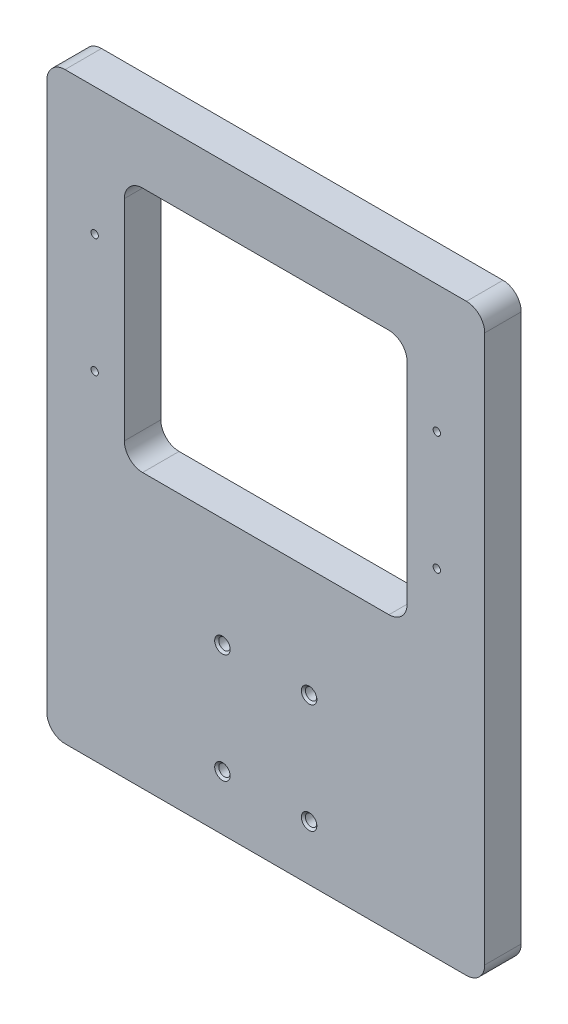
SolidWorks part; units mm, degrees
ref_plane "Front" through (0, 0, 0) normal (0, 0, 1) x (1, 0, 0)
ref_plane "Top" through (0, 0, 0) normal (0, 1, 0) x (1, 0, 0)
ref_plane "Right" through (0, 0, 0) normal (1, 0, 0) x (0, 0, -1)
sketch "Sketch1" plane through (0, 0, 0) normal (0, 0, 1) x (1, 0, 0)
  line L1 (0, 0) -> (304.8, 0)
  line L2 (0, 0) -> (0, 406.4)
  line L3 (0, 406.4) -> (304.8, 406.4)
  line L4 (304.8, 0) -> (304.8, 406.4)
  dimension "D1" = 304.8
  dimension "D2" = 406.4
extrude "Boss-Extrude1" add sketch "Sketch1" along normal blind 25.4 contours L3 L4 L1 L2
sketch "Snoot Location Ref." plane through (0, 0, 25.4) normal (0, 0, 1) x (1, 0, 0)
  line L0 (0, 0) -> (0, 406.4) construction
  line L1 (0, 0) -> (304.8, 0) construction
  circle A0 centre (152.4, 317.5) radius 27.051 construction
  circle A1 centre (152.4, 234.95) radius 27.051 construction
  circle A2 centre (193.675, 276.225) radius 12.7 construction
  circle A3 centre (111.125, 276.225) radius 12.7 construction
  dimension "D1" = 54.102
  dimension "D7" = 41.275
  dimension "D8" = 25.4
  dimension "D2" = 152.4
  dimension "D3" = 234.95
  dimension "D4" = 82.55
  dimension "D5" = 82.55
  dimension "D6" = 41.275
sketch "I-Beam Location Ref." plane through (0, 0, 25.4) normal (0, 0, 1) x (1, 0, 0)
  line L0 (0, 0) -> (304.8, 0) construction
  line L2 (101.6, 0) -> (101.6, 152.4) construction
  line L3 (101.6, 152.4) -> (203.2, 152.4) construction
  line L4 (203.2, 0) -> (203.2, 152.4) construction
  line L5 (0, 0) -> (0, 406.4) construction
  line L6 (147.574, 0) -> (147.574, 152.4) construction
  line L7 (157.226, 152.4) -> (157.226, 0) construction
  point P12 (152.4, 152.4)
  dimension "D1" = 101.6
  dimension "D2" = 101.6
  dimension "D3" = 152.4
  dimension "D4" = 9.652
  dimension "D5" = 4.826
hole_wizard "3/8-16 Tapped Hole1" positions "Sketch5" profile "Sketch6" tap size "3/8-16" standard "ANSI Inch"
sketch "Sketch5" plane through (0, 0, 25.4) normal (0, 0, 1) x (1, 0, 0)
  line L0 (0, 0) -> (304.8, 0) construction
  line L1 (0, 0) -> (0, 406.4) construction
  line L2 (152.4, 152.4) -> (152.4, 0) construction
  line L3 (101.6, 152.4) -> (203.2, 152.4) construction
  point P0 (122.2375, 38.1)
  point P2 (122.2375, 114.3)
  point P15 (182.5625, 38.1)
  point P16 (182.5625, 114.3)
  dimension "D1" = 38.1
  dimension "D2" = 76.2
  dimension "D3" = 122.2375
sketch "Sketch6" plane through (122.2375, 38.1, 25.4) normal (1, 0, 0) x (0, -1, 0)
  line L0 (0, 0) -> (0, 25.4)
  line L1 (0, 25.4) -> (5.3975, 25.4)
  line L2 (3.9687, 23.9712) -> (3.9687, 1.4287)
  line L3 (3.9687, 1.4287) -> (5.3975, 0)
  line L5 (5.3975, 0) -> (0, 0)
  line L6 (-3.9687, 1.4287) -> (-5.3975, 0) construction
  line L7 (5.3975, 25.4) -> (3.9687, 23.9712)
  line L8 (-5.3975, 25.4) -> (-3.9688, 23.9712) construction
  line L11 (0, -6.35) -> (0, 107.95) construction
  dimension "Thru Tap Drill Dia." = 7.9375
  dimension "Thru Tap Drill Depth" = 25.4
  dimension "Near C'Sink Dia." = 10.795
  dimension "Near C'Sink Angle" = 90
  dimension "Far C'Sink Dia." = 10.795
  dimension "Far C'Sink Angle" = 90
sketch "Sketch7" plane through (0, 0, 25.4) normal (0, 0, 1) x (1, 0, 0)
  line L0 (0, 0) -> (0, 406.4) construction
  line L1 (66.675, 190.5) -> (238.125, 190.5)
  line L2 (53.975, 203.2) -> (53.975, 349.25)
  line L3 (66.675, 361.95) -> (238.125, 361.95)
  line L4 (250.825, 203.2) -> (250.825, 349.25)
  line L5 (0, 0) -> (304.8, 0) construction
  arc A0 (66.675, 190.5) -> (53.975, 203.2) centre (66.675, 203.2) cw
  arc A1 (238.125, 190.5) -> (250.825, 203.2) centre (238.125, 203.2) ccw
  arc A2 (238.125, 361.95) -> (250.825, 349.25) centre (238.125, 349.25) cw
  arc A3 (53.975, 349.25) -> (66.675, 361.95) centre (66.675, 349.25) cw
  point P4 (152.4, 190.5)
  point P7 (53.975, 276.225)
  dimension "D5" = 12.7
  dimension "D1" = 152.4
  dimension "D2" = 276.225
  dimension "D3" = 57.15
  dimension "D4" = 44.45
extrude "Cut-Extrude1" cut sketch "Sketch7" against normal through all
hole_wizard "1/4-20 Tapped Hole1" positions "Sketch8" profile "Sketch9" tap size "1/4-20" standard "ANSI Inch"
sketch "Sketch8" plane through (0, 0, 25.4) normal (0, 0, 1) x (1, 0, 0)
  line L0 (0, 0) -> (0, 406.4) construction
  line L2 (111.125, 276.225) -> (193.675, 276.225) construction
  point P0 (33.3375, 317.5)
  point P2 (271.4625, 317.5)
  point P15 (271.4625, 234.95)
  point P16 (33.3375, 234.95)
  dimension "D1" = 238.125
  dimension "D2" = 33.3375
sketch "Sketch9" plane through (33.3375, 317.5, 25.4) normal (1, 0, 0) x (0, -1, 0)
  line L0 (0, 0) -> (0, 25.4)
  line L1 (0, 25.4) -> (2.5527, 25.4)
  line L2 (2.5527, 25.4) -> (2.5527, 0)
  line L5 (2.5527, 0) -> (0, 0)
  line L11 (0, -6.35) -> (0, 107.95) construction
  dimension "Thru Tap Drill Dia." = 5.1054
  dimension "Thru Tap Drill Depth" = 25.4
fillet "Fillet1" radius 12.7 4 edges at (0, 0, 12.7) (304.8, 0, 12.7) (304.8, 406.4, 12.7) (0, 406.4, 12.7)
